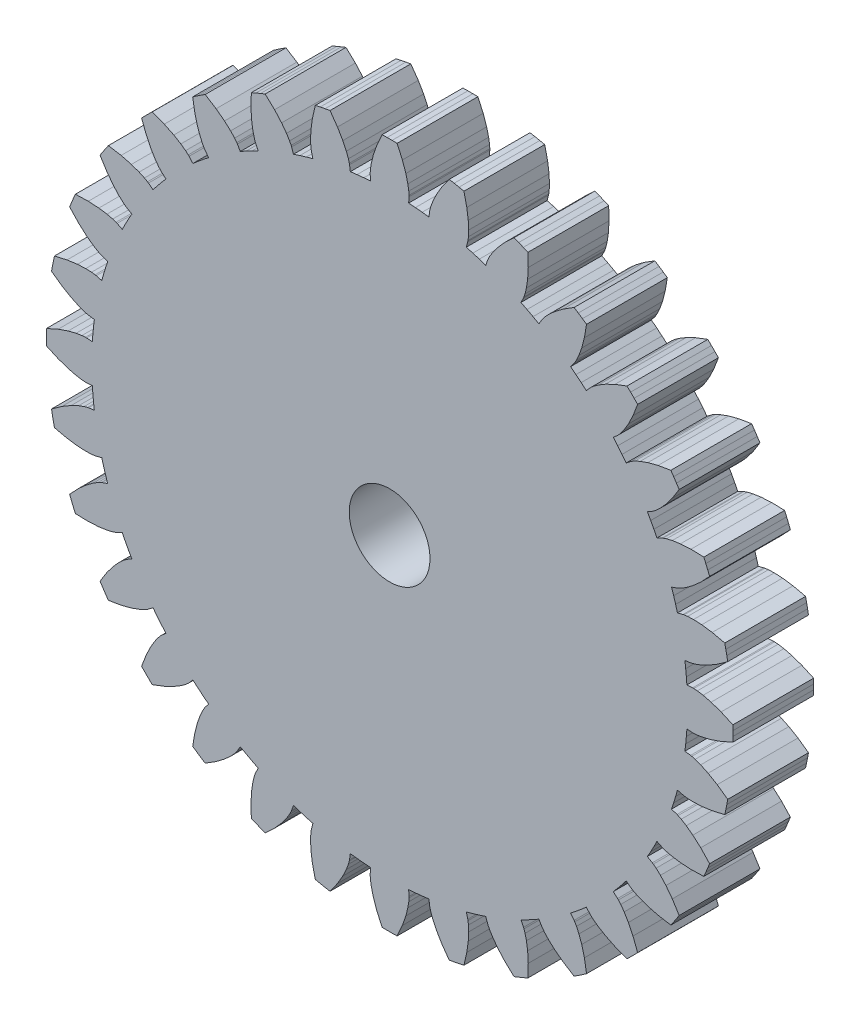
SolidWorks part; units mm, degrees
ref_plane "前视基准面" through (0, 0, 0) normal (0, 0, 1) x (1, 0, 0)
ref_plane "上视基准面" through (0, 0, 0) normal (0, 1, 0) x (1, 0, 0)
ref_plane "右视基准面" through (0, 0, 0) normal (1, 0, 0) x (0, 0, -1)
other "Configuration Table"
sketch "草图1" plane through (0, 0, 0) normal (0, 0, 1) x (1, 0, 0)
  line L0 (22.0797, -1.4149) -> (22.5065, -1.4422)
  line L1 (22.5065, -1.4422) -> (22.5937, -1.4427)
  line L2 (22.5937, -1.4427) -> (22.8546, -1.4236)
  line L3 (22.8546, -1.4236) -> (23.285, -1.3547)
  line L4 (23.285, -1.3547) -> (23.877, -1.2061)
  line L5 (23.877, -1.2061) -> (24.6186, -0.9493)
  line L6 (24.6186, -0.9493) -> (25.4939, -0.5573)
  line L7 (25.4939, -0.5573) -> (25.4993, -0.1858)
  line L8 (25.4993, -0.1858) -> (25.4993, 0.1858)
  line L9 (25.4993, 0.1858) -> (25.4939, 0.5573)
  line L10 (25.4939, 0.5573) -> (24.6186, 0.9493)
  line L11 (24.6186, 0.9493) -> (23.877, 1.2061)
  line L12 (23.877, 1.2061) -> (23.285, 1.3547)
  line L13 (23.285, 1.3547) -> (22.8546, 1.4236)
  line L14 (22.8546, 1.4236) -> (22.5937, 1.4427)
  line L15 (22.5937, 1.4427) -> (22.5065, 1.4422)
  line L16 (22.5065, 1.4422) -> (22.0797, 1.4149)
  line L17 (22.0797, 1.4149) -> (22.0417, 1.9176)
  line L18 (22.0417, 1.9176) -> (21.9923, 2.4194)
  line L19 (21.9923, 2.4194) -> (21.9315, 2.9199)
  line L20 (21.9315, 2.9199) -> (22.3554, 2.9763)
  line L21 (22.3554, 2.9763) -> (22.441, 2.9929)
  line L22 (22.441, 2.9929) -> (22.6931, 3.0624)
  line L23 (22.6931, 3.0624) -> (23.1019, 3.214)
  line L24 (23.1019, 3.214) -> (23.6535, 3.4753)
  line L25 (23.6535, 3.4753) -> (24.3307, 3.8718)
  line L26 (24.3307, 3.8718) -> (25.1128, 4.4271)
  line L27 (25.1128, 4.4271) -> (25.0456, 4.7925)
  line L28 (25.0456, 4.7925) -> (24.9731, 5.1569)
  line L29 (24.9731, 5.1569) -> (24.8953, 5.5202)
  line L30 (24.8953, 5.5202) -> (23.9603, 5.7339)
  line L31 (23.9603, 5.7339) -> (23.1829, 5.8411)
  line L32 (23.1829, 5.8411) -> (22.5733, 5.8713)
  line L33 (22.5733, 5.8713) -> (22.1377, 5.855)
  line L34 (22.1377, 5.855) -> (21.8781, 5.8227)
  line L35 (21.8781, 5.8227) -> (21.7926, 5.8053)
  line L36 (21.7926, 5.8053) -> (21.3794, 5.6952)
  line L37 (21.3794, 5.6952) -> (21.2441, 6.1809)
  line L38 (21.2441, 6.1809) -> (21.0978, 6.6634)
  line L39 (21.0978, 6.6634) -> (20.9404, 7.1424)
  line L40 (20.9404, 7.1424) -> (21.3452, 7.2804)
  line L41 (21.3452, 7.2804) -> (21.4259, 7.3134)
  line L42 (21.4259, 7.3134) -> (21.6597, 7.4308)
  line L43 (21.6597, 7.4308) -> (22.031, 7.6592)
  line L44 (22.031, 7.6592) -> (22.5211, 8.0231)
  line L45 (22.5211, 8.0231) -> (23.1079, 8.5441)
  line L46 (23.1079, 8.5441) -> (23.7666, 9.2413)
  line L47 (23.7666, 9.2413) -> (23.6294, 9.5865)
  line L48 (23.6294, 9.5865) -> (23.4872, 9.9298)
  line L49 (23.4872, 9.9298) -> (23.34, 10.2709)
  line L50 (23.34, 10.2709) -> (22.3813, 10.2981)
  line L51 (22.3813, 10.2981) -> (21.5979, 10.2516)
  line L52 (21.5979, 10.2516) -> (20.9942, 10.1624)
  line L53 (20.9942, 10.1624) -> (20.5701, 10.0613)
  line L54 (20.5701, 10.0613) -> (20.3217, 9.9791)
  line L55 (20.3217, 9.9791) -> (20.2414, 9.9453)
  line L56 (20.2414, 9.9453) -> (19.8576, 9.7567)
  line L57 (19.8576, 9.7567) -> (19.6301, 10.2066)
  line L58 (19.6301, 10.2066) -> (19.3924, 10.6513)
  line L59 (19.3924, 10.6513) -> (19.1447, 11.0904)
  line L60 (19.1447, 11.0904) -> (19.5147, 11.3048)
  line L61 (19.5147, 11.3048) -> (19.5874, 11.3528)
  line L62 (19.5874, 11.3528) -> (19.7938, 11.5136)
  line L63 (19.7938, 11.5136) -> (20.1134, 11.8101)
  line L64 (20.1134, 11.8101) -> (20.5231, 12.2625)
  line L65 (20.5231, 12.2625) -> (20.997, 12.888)
  line L66 (20.997, 12.888) -> (21.507, 13.7003)
  line L67 (21.507, 13.7003) -> (21.3051, 14.0122)
  line L68 (21.3051, 14.0122) -> (21.0987, 14.3211)
  line L69 (21.0987, 14.3211) -> (20.8878, 14.627)
  line L70 (20.8878, 14.627) -> (19.9422, 14.4666)
  line L71 (19.9422, 14.4666) -> (19.183, 14.2682)
  line L72 (19.183, 14.2682) -> (18.6082, 14.0629)
  line L73 (18.6082, 14.0629) -> (18.2119, 13.881)
  line L74 (18.2119, 13.881) -> (17.9844, 13.7519)
  line L75 (17.9844, 13.7519) -> (17.9122, 13.7031)
  line L76 (17.9122, 13.7031) -> (17.5726, 13.4432)
  line L77 (17.5726, 13.4432) -> (17.2617, 13.8402)
  line L78 (17.2617, 13.8402) -> (16.9418, 14.2299)
  line L79 (16.9418, 14.2299) -> (16.6132, 14.6123)
  line L80 (16.6132, 14.6123) -> (16.9343, 14.8947)
  line L81 (16.9343, 14.8947) -> (16.9963, 14.956)
  line L82 (16.9963, 14.956) -> (17.1673, 15.1539)
  line L83 (17.1673, 15.1539) -> (17.4229, 15.5071)
  line L84 (17.4229, 15.5071) -> (17.7364, 16.0308)
  line L85 (17.7364, 16.0308) -> (18.0792, 16.7367)
  line L86 (18.0792, 16.7367) -> (18.421, 17.6329)
  line L87 (18.421, 17.6329) -> (18.1621, 17.8994)
  line L88 (18.1621, 17.8994) -> (17.8994, 18.1621)
  line L89 (17.8994, 18.1621) -> (17.6329, 18.421)
  line L90 (17.6329, 18.421) -> (16.7367, 18.0792)
  line L91 (16.7367, 18.0792) -> (16.0308, 17.7364)
  line L92 (16.0308, 17.7364) -> (15.5071, 17.4229)
  line L93 (15.5071, 17.4229) -> (15.1539, 17.1673)
  line L94 (15.1539, 17.1673) -> (14.956, 16.9963)
  line L95 (14.956, 16.9963) -> (14.8947, 16.9343)
  line L96 (14.8947, 16.9343) -> (14.6123, 16.6132)
  line L97 (14.6123, 16.6132) -> (14.2299, 16.9418)
  line L98 (14.2299, 16.9418) -> (13.8402, 17.2617)
  line L99 (13.8402, 17.2617) -> (13.4432, 17.5726)
  line L100 (13.4432, 17.5726) -> (13.7031, 17.9122)
  line L101 (13.7031, 17.9122) -> (13.7519, 17.9844)
  line L102 (13.7519, 17.9844) -> (13.881, 18.2119)
  line L103 (13.881, 18.2119) -> (14.0629, 18.6082)
  line L104 (14.0629, 18.6082) -> (14.2682, 19.183)
  line L105 (14.2682, 19.183) -> (14.4666, 19.9422)
  line L106 (14.4666, 19.9422) -> (14.627, 20.8878)
  line L107 (14.627, 20.8878) -> (14.3211, 21.0987)
  line L108 (14.3211, 21.0987) -> (14.0122, 21.3051)
  line L109 (14.0122, 21.3051) -> (13.7003, 21.507)
  line L110 (13.7003, 21.507) -> (12.888, 20.997)
  line L111 (12.888, 20.997) -> (12.2625, 20.5231)
  line L112 (12.2625, 20.5231) -> (11.8101, 20.1134)
  line L113 (11.8101, 20.1134) -> (11.5136, 19.7938)
  line L114 (11.5136, 19.7938) -> (11.3528, 19.5874)
  line L115 (11.3528, 19.5874) -> (11.3048, 19.5147)
  line L116 (11.3048, 19.5147) -> (11.0904, 19.1447)
  line L117 (11.0904, 19.1447) -> (10.6513, 19.3924)
  line L118 (10.6513, 19.3924) -> (10.2066, 19.6301)
  line L119 (10.2066, 19.6301) -> (9.7567, 19.8576)
  line L120 (9.7567, 19.8576) -> (9.9453, 20.2414)
  line L121 (9.9453, 20.2414) -> (9.9791, 20.3217)
  line L122 (9.9791, 20.3217) -> (10.0613, 20.5701)
  line L123 (10.0613, 20.5701) -> (10.1624, 20.9942)
  line L124 (10.1624, 20.9942) -> (10.2516, 21.5979)
  line L125 (10.2516, 21.5979) -> (10.2981, 22.3813)
  line L126 (10.2981, 22.3813) -> (10.2709, 23.34)
  line L127 (10.2709, 23.34) -> (9.9298, 23.4872)
  line L128 (9.9298, 23.4872) -> (9.5865, 23.6294)
  line L129 (9.5865, 23.6294) -> (9.2413, 23.7666)
  line L130 (9.2413, 23.7666) -> (8.5441, 23.1079)
  line L131 (8.5441, 23.1079) -> (8.0231, 22.5211)
  line L132 (8.0231, 22.5211) -> (7.6592, 22.031)
  line L133 (7.6592, 22.031) -> (7.4308, 21.6597)
  line L134 (7.4308, 21.6597) -> (7.3134, 21.4259)
  line L135 (7.3134, 21.4259) -> (7.2804, 21.3452)
  line L136 (7.2804, 21.3452) -> (7.1424, 20.9404)
  line L137 (7.1424, 20.9404) -> (6.6634, 21.0978)
  line L138 (6.6634, 21.0978) -> (6.1809, 21.2441)
  line L139 (6.1809, 21.2441) -> (5.6952, 21.3794)
  line L140 (5.6952, 21.3794) -> (5.8053, 21.7926)
  line L141 (5.8053, 21.7926) -> (5.8227, 21.8781)
  line L142 (5.8227, 21.8781) -> (5.855, 22.1377)
  line L143 (5.855, 22.1377) -> (5.8713, 22.5733)
  line L144 (5.8713, 22.5733) -> (5.8411, 23.1829)
  line L145 (5.8411, 23.1829) -> (5.7339, 23.9603)
  line L146 (5.7339, 23.9603) -> (5.5202, 24.8953)
  line L147 (5.5202, 24.8953) -> (5.1569, 24.9731)
  line L148 (5.1569, 24.9731) -> (4.7925, 25.0456)
  line L149 (4.7925, 25.0456) -> (4.4271, 25.1128)
  line L150 (4.4271, 25.1128) -> (3.8718, 24.3307)
  line L151 (3.8718, 24.3307) -> (3.4753, 23.6535)
  line L152 (3.4753, 23.6535) -> (3.214, 23.1019)
  line L153 (3.214, 23.1019) -> (3.0624, 22.6931)
  line L154 (3.0624, 22.6931) -> (2.9929, 22.441)
  line L155 (2.9929, 22.441) -> (2.9763, 22.3554)
  line L156 (2.9763, 22.3554) -> (2.9199, 21.9315)
  line L157 (2.9199, 21.9315) -> (2.4194, 21.9923)
  line L158 (2.4194, 21.9923) -> (1.9176, 22.0417)
  line L159 (1.9176, 22.0417) -> (1.4149, 22.0797)
  line L160 (1.4149, 22.0797) -> (1.4422, 22.5065)
  line L161 (1.4422, 22.5065) -> (1.4427, 22.5937)
  line L162 (1.4427, 22.5937) -> (1.4236, 22.8546)
  line L163 (1.4236, 22.8546) -> (1.3547, 23.285)
  line L164 (1.3547, 23.285) -> (1.2061, 23.877)
  line L165 (1.2061, 23.877) -> (0.9493, 24.6186)
  line L166 (0.9493, 24.6186) -> (0.5573, 25.4939)
  line L167 (0.5573, 25.4939) -> (0.1858, 25.4993)
  line L168 (0.1858, 25.4993) -> (-0.1858, 25.4993)
  line L169 (-0.1858, 25.4993) -> (-0.5573, 25.4939)
  line L170 (-0.5573, 25.4939) -> (-0.9493, 24.6186)
  line L171 (-0.9493, 24.6186) -> (-1.2061, 23.877)
  line L172 (-1.2061, 23.877) -> (-1.3547, 23.285)
  line L173 (-1.3547, 23.285) -> (-1.4236, 22.8546)
  line L174 (-1.4236, 22.8546) -> (-1.4427, 22.5937)
  line L175 (-1.4427, 22.5937) -> (-1.4422, 22.5065)
  line L176 (-1.4422, 22.5065) -> (-1.4149, 22.0797)
  line L177 (-1.4149, 22.0797) -> (-1.9176, 22.0417)
  line L178 (-1.9176, 22.0417) -> (-2.4194, 21.9923)
  line L179 (-2.4194, 21.9923) -> (-2.9199, 21.9315)
  line L180 (-2.9199, 21.9315) -> (-2.9763, 22.3554)
  line L181 (-2.9763, 22.3554) -> (-2.9929, 22.441)
  line L182 (-2.9929, 22.441) -> (-3.0624, 22.6931)
  line L183 (-3.0624, 22.6931) -> (-3.214, 23.1019)
  line L184 (-3.214, 23.1019) -> (-3.4753, 23.6535)
  line L185 (-3.4753, 23.6535) -> (-3.8718, 24.3307)
  line L186 (-3.8718, 24.3307) -> (-4.4271, 25.1128)
  line L187 (-4.4271, 25.1128) -> (-4.7925, 25.0456)
  line L188 (-4.7925, 25.0456) -> (-5.1569, 24.9731)
  line L189 (-5.1569, 24.9731) -> (-5.5202, 24.8953)
  line L190 (-5.5202, 24.8953) -> (-5.7339, 23.9603)
  line L191 (-5.7339, 23.9603) -> (-5.8411, 23.1829)
  line L192 (-5.8411, 23.1829) -> (-5.8713, 22.5733)
  line L193 (-5.8713, 22.5733) -> (-5.855, 22.1377)
  line L194 (-5.855, 22.1377) -> (-5.8227, 21.8781)
  line L195 (-5.8227, 21.8781) -> (-5.8053, 21.7926)
  line L196 (-5.8053, 21.7926) -> (-5.6952, 21.3794)
  line L197 (-5.6952, 21.3794) -> (-6.1809, 21.2441)
  line L198 (-6.1809, 21.2441) -> (-6.6634, 21.0978)
  line L199 (-6.6634, 21.0978) -> (-7.1424, 20.9404)
  line L200 (-7.1424, 20.9404) -> (-7.2804, 21.3452)
  line L201 (-7.2804, 21.3452) -> (-7.3134, 21.4259)
  line L202 (-7.3134, 21.4259) -> (-7.4308, 21.6597)
  line L203 (-7.4308, 21.6597) -> (-7.6592, 22.031)
  line L204 (-7.6592, 22.031) -> (-8.0231, 22.5211)
  line L205 (-8.0231, 22.5211) -> (-8.5441, 23.1079)
  line L206 (-8.5441, 23.1079) -> (-9.2413, 23.7666)
  line L207 (-9.2413, 23.7666) -> (-9.5865, 23.6294)
  line L208 (-9.5865, 23.6294) -> (-9.9298, 23.4872)
  line L209 (-9.9298, 23.4872) -> (-10.2709, 23.34)
  line L210 (-10.2709, 23.34) -> (-10.2981, 22.3813)
  line L211 (-10.2981, 22.3813) -> (-10.2516, 21.5979)
  line L212 (-10.2516, 21.5979) -> (-10.1624, 20.9942)
  line L213 (-10.1624, 20.9942) -> (-10.0613, 20.5701)
  line L214 (-10.0613, 20.5701) -> (-9.9791, 20.3217)
  line L215 (-9.9791, 20.3217) -> (-9.9453, 20.2414)
  line L216 (-9.9453, 20.2414) -> (-9.7567, 19.8576)
  line L217 (-9.7567, 19.8576) -> (-10.2066, 19.6301)
  line L218 (-10.2066, 19.6301) -> (-10.6513, 19.3924)
  line L219 (-10.6513, 19.3924) -> (-11.0904, 19.1447)
  line L220 (-11.0904, 19.1447) -> (-11.3048, 19.5147)
  line L221 (-11.3048, 19.5147) -> (-11.3528, 19.5874)
  line L222 (-11.3528, 19.5874) -> (-11.5136, 19.7938)
  line L223 (-11.5136, 19.7938) -> (-11.8101, 20.1134)
  line L224 (-11.8101, 20.1134) -> (-12.2625, 20.5231)
  line L225 (-12.2625, 20.5231) -> (-12.888, 20.997)
  line L226 (-12.888, 20.997) -> (-13.7003, 21.507)
  line L227 (-13.7003, 21.507) -> (-14.0122, 21.3051)
  line L228 (-14.0122, 21.3051) -> (-14.3211, 21.0987)
  line L229 (-14.3211, 21.0987) -> (-14.627, 20.8878)
  line L230 (-14.627, 20.8878) -> (-14.4666, 19.9422)
  line L231 (-14.4666, 19.9422) -> (-14.2682, 19.183)
  line L232 (-14.2682, 19.183) -> (-14.0629, 18.6082)
  line L233 (-14.0629, 18.6082) -> (-13.881, 18.2119)
  line L234 (-13.881, 18.2119) -> (-13.7519, 17.9844)
  line L235 (-13.7519, 17.9844) -> (-13.7031, 17.9122)
  line L236 (-13.7031, 17.9122) -> (-13.4432, 17.5726)
  line L237 (-13.4432, 17.5726) -> (-13.8402, 17.2617)
  line L238 (-13.8402, 17.2617) -> (-14.2299, 16.9418)
  line L239 (-14.2299, 16.9418) -> (-14.6123, 16.6132)
  line L240 (-14.6123, 16.6132) -> (-14.8947, 16.9343)
  line L241 (-14.8947, 16.9343) -> (-14.956, 16.9963)
  line L242 (-14.956, 16.9963) -> (-15.1539, 17.1673)
  line L243 (-15.1539, 17.1673) -> (-15.5071, 17.4229)
  line L244 (-15.5071, 17.4229) -> (-16.0308, 17.7364)
  line L245 (-16.0308, 17.7364) -> (-16.7367, 18.0792)
  line L246 (-16.7367, 18.0792) -> (-17.6329, 18.421)
  line L247 (-17.6329, 18.421) -> (-17.8994, 18.1621)
  line L248 (-17.8994, 18.1621) -> (-18.1621, 17.8994)
  line L249 (-18.1621, 17.8994) -> (-18.421, 17.6329)
  line L250 (-18.421, 17.6329) -> (-18.0792, 16.7367)
  line L251 (-18.0792, 16.7367) -> (-17.7364, 16.0308)
  line L252 (-17.7364, 16.0308) -> (-17.4229, 15.5071)
  line L253 (-17.4229, 15.5071) -> (-17.1673, 15.1539)
  line L254 (-17.1673, 15.1539) -> (-16.9963, 14.956)
  line L255 (-16.9963, 14.956) -> (-16.9343, 14.8947)
  line L256 (-16.9343, 14.8947) -> (-16.6132, 14.6123)
  line L257 (-16.6132, 14.6123) -> (-16.9418, 14.2299)
  line L258 (-16.9418, 14.2299) -> (-17.2617, 13.8402)
  line L259 (-17.2617, 13.8402) -> (-17.5726, 13.4432)
  line L260 (-17.5726, 13.4432) -> (-17.9122, 13.7031)
  line L261 (-17.9122, 13.7031) -> (-17.9844, 13.7519)
  line L262 (-17.9844, 13.7519) -> (-18.2119, 13.881)
  line L263 (-18.2119, 13.881) -> (-18.6082, 14.0629)
  line L264 (-18.6082, 14.0629) -> (-19.183, 14.2682)
  line L265 (-19.183, 14.2682) -> (-19.9422, 14.4666)
  line L266 (-19.9422, 14.4666) -> (-20.8878, 14.627)
  line L267 (-20.8878, 14.627) -> (-21.0987, 14.3211)
  line L268 (-21.0987, 14.3211) -> (-21.3051, 14.0122)
  line L269 (-21.3051, 14.0122) -> (-21.507, 13.7003)
  line L270 (-21.507, 13.7003) -> (-20.997, 12.888)
  line L271 (-20.997, 12.888) -> (-20.5231, 12.2625)
  line L272 (-20.5231, 12.2625) -> (-20.1134, 11.8101)
  line L273 (-20.1134, 11.8101) -> (-19.7938, 11.5136)
  line L274 (-19.7938, 11.5136) -> (-19.5874, 11.3528)
  line L275 (-19.5874, 11.3528) -> (-19.5147, 11.3048)
  line L276 (-19.5147, 11.3048) -> (-19.1447, 11.0904)
  line L277 (-19.1447, 11.0904) -> (-19.3924, 10.6513)
  line L278 (-19.3924, 10.6513) -> (-19.6301, 10.2066)
  line L279 (-19.6301, 10.2066) -> (-19.8576, 9.7567)
  line L280 (-19.8576, 9.7567) -> (-20.2414, 9.9453)
  line L281 (-20.2414, 9.9453) -> (-20.3217, 9.9791)
  line L282 (-20.3217, 9.9791) -> (-20.5701, 10.0613)
  line L283 (-20.5701, 10.0613) -> (-20.9942, 10.1624)
  line L284 (-20.9942, 10.1624) -> (-21.5979, 10.2516)
  line L285 (-21.5979, 10.2516) -> (-22.3813, 10.2981)
  line L286 (-22.3813, 10.2981) -> (-23.34, 10.2709)
  line L287 (-23.34, 10.2709) -> (-23.4872, 9.9298)
  line L288 (-23.4872, 9.9298) -> (-23.6294, 9.5865)
  line L289 (-23.6294, 9.5865) -> (-23.7666, 9.2413)
  line L290 (-23.7666, 9.2413) -> (-23.1079, 8.5441)
  line L291 (-23.1079, 8.5441) -> (-22.5211, 8.0231)
  line L292 (-22.5211, 8.0231) -> (-22.031, 7.6592)
  line L293 (-22.031, 7.6592) -> (-21.6597, 7.4308)
  line L294 (-21.6597, 7.4308) -> (-21.4259, 7.3134)
  line L295 (-21.4259, 7.3134) -> (-21.3452, 7.2804)
  line L296 (-21.3452, 7.2804) -> (-20.9404, 7.1424)
  line L297 (-20.9404, 7.1424) -> (-21.0978, 6.6634)
  line L298 (-21.0978, 6.6634) -> (-21.2441, 6.1809)
  line L299 (-21.2441, 6.1809) -> (-21.3794, 5.6952)
  line L300 (-21.3794, 5.6952) -> (-21.7926, 5.8053)
  line L301 (-21.7926, 5.8053) -> (-21.8781, 5.8227)
  line L302 (-21.8781, 5.8227) -> (-22.1377, 5.855)
  line L303 (-22.1377, 5.855) -> (-22.5733, 5.8713)
  line L304 (-22.5733, 5.8713) -> (-23.1829, 5.8411)
  line L305 (-23.1829, 5.8411) -> (-23.9603, 5.7339)
  line L306 (-23.9603, 5.7339) -> (-24.8953, 5.5202)
  line L307 (-24.8953, 5.5202) -> (-24.9731, 5.1569)
  line L308 (-24.9731, 5.1569) -> (-25.0456, 4.7925)
  line L309 (-25.0456, 4.7925) -> (-25.1128, 4.4271)
  line L310 (-25.1128, 4.4271) -> (-24.3307, 3.8718)
  line L311 (-24.3307, 3.8718) -> (-23.6535, 3.4753)
  line L312 (-23.6535, 3.4753) -> (-23.1019, 3.214)
  line L313 (-23.1019, 3.214) -> (-22.6931, 3.0624)
  line L314 (-22.6931, 3.0624) -> (-22.441, 2.9929)
  line L315 (-22.441, 2.9929) -> (-22.3554, 2.9763)
  line L316 (-22.3554, 2.9763) -> (-21.9315, 2.9199)
  line L317 (-21.9315, 2.9199) -> (-21.9923, 2.4194)
  line L318 (-21.9923, 2.4194) -> (-22.0417, 1.9176)
  line L319 (-22.0417, 1.9176) -> (-22.0797, 1.4149)
  line L320 (-22.0797, 1.4149) -> (-22.5065, 1.4422)
  line L321 (-22.5065, 1.4422) -> (-22.5937, 1.4427)
  line L322 (-22.5937, 1.4427) -> (-22.8546, 1.4236)
  line L323 (-22.8546, 1.4236) -> (-23.285, 1.3547)
  line L324 (-23.285, 1.3547) -> (-23.877, 1.2061)
  line L325 (-23.877, 1.2061) -> (-24.6186, 0.9493)
  line L326 (-24.6186, 0.9493) -> (-25.4939, 0.5573)
  line L327 (-25.4939, 0.5573) -> (-25.4993, 0.1858)
  line L328 (-25.4993, 0.1858) -> (-25.4993, -0.1858)
  line L329 (-25.4993, -0.1858) -> (-25.4939, -0.5573)
  line L330 (-25.4939, -0.5573) -> (-24.6186, -0.9493)
  line L331 (-24.6186, -0.9493) -> (-23.877, -1.2061)
  line L332 (-23.877, -1.2061) -> (-23.285, -1.3547)
  line L333 (-23.285, -1.3547) -> (-22.8546, -1.4236)
  line L334 (-22.8546, -1.4236) -> (-22.5937, -1.4427)
  line L335 (-22.5937, -1.4427) -> (-22.5065, -1.4422)
  line L336 (-22.5065, -1.4422) -> (-22.0797, -1.4149)
  line L337 (-22.0797, -1.4149) -> (-22.0417, -1.9176)
  line L338 (-22.0417, -1.9176) -> (-21.9923, -2.4194)
  line L339 (-21.9923, -2.4194) -> (-21.9315, -2.9199)
  line L340 (-21.9315, -2.9199) -> (-22.3554, -2.9763)
  line L341 (-22.3554, -2.9763) -> (-22.441, -2.9929)
  line L342 (-22.441, -2.9929) -> (-22.6931, -3.0624)
  line L343 (-22.6931, -3.0624) -> (-23.1019, -3.214)
  line L344 (-23.1019, -3.214) -> (-23.6535, -3.4753)
  line L345 (-23.6535, -3.4753) -> (-24.3307, -3.8718)
  line L346 (-24.3307, -3.8718) -> (-25.1128, -4.4271)
  line L347 (-25.1128, -4.4271) -> (-25.0456, -4.7925)
  line L348 (-25.0456, -4.7925) -> (-24.9731, -5.1569)
  line L349 (-24.9731, -5.1569) -> (-24.8953, -5.5202)
  line L350 (-24.8953, -5.5202) -> (-23.9603, -5.7339)
  line L351 (-23.9603, -5.7339) -> (-23.1829, -5.8411)
  line L352 (-23.1829, -5.8411) -> (-22.5733, -5.8713)
  line L353 (-22.5733, -5.8713) -> (-22.1377, -5.855)
  line L354 (-22.1377, -5.855) -> (-21.8781, -5.8227)
  line L355 (-21.8781, -5.8227) -> (-21.7926, -5.8053)
  line L356 (-21.7926, -5.8053) -> (-21.3794, -5.6952)
  line L357 (-21.3794, -5.6952) -> (-21.2441, -6.1809)
  line L358 (-21.2441, -6.1809) -> (-21.0978, -6.6634)
  line L359 (-21.0978, -6.6634) -> (-20.9404, -7.1424)
  line L360 (-20.9404, -7.1424) -> (-21.3452, -7.2804)
  line L361 (-21.3452, -7.2804) -> (-21.4259, -7.3134)
  line L362 (-21.4259, -7.3134) -> (-21.6597, -7.4308)
  line L363 (-21.6597, -7.4308) -> (-22.031, -7.6592)
  line L364 (-22.031, -7.6592) -> (-22.5211, -8.0231)
  line L365 (-22.5211, -8.0231) -> (-23.1079, -8.5441)
  line L366 (-23.1079, -8.5441) -> (-23.7666, -9.2413)
  line L367 (-23.7666, -9.2413) -> (-23.6294, -9.5865)
  line L368 (-23.6294, -9.5865) -> (-23.4872, -9.9298)
  line L369 (-23.4872, -9.9298) -> (-23.34, -10.2709)
  line L370 (-23.34, -10.2709) -> (-22.3813, -10.2981)
  line L371 (-22.3813, -10.2981) -> (-21.5979, -10.2516)
  line L372 (-21.5979, -10.2516) -> (-20.9942, -10.1624)
  line L373 (-20.9942, -10.1624) -> (-20.5701, -10.0613)
  line L374 (-20.5701, -10.0613) -> (-20.3217, -9.9791)
  line L375 (-20.3217, -9.9791) -> (-20.2414, -9.9453)
  line L376 (-20.2414, -9.9453) -> (-19.8576, -9.7567)
  line L377 (-19.8576, -9.7567) -> (-19.6301, -10.2066)
  line L378 (-19.6301, -10.2066) -> (-19.3924, -10.6513)
  line L379 (-19.3924, -10.6513) -> (-19.1447, -11.0904)
  line L380 (-19.1447, -11.0904) -> (-19.5147, -11.3048)
  line L381 (-19.5147, -11.3048) -> (-19.5874, -11.3528)
  line L382 (-19.5874, -11.3528) -> (-19.7938, -11.5136)
  line L383 (-19.7938, -11.5136) -> (-20.1134, -11.8101)
  line L384 (-20.1134, -11.8101) -> (-20.5231, -12.2625)
  line L385 (-20.5231, -12.2625) -> (-20.997, -12.888)
  line L386 (-20.997, -12.888) -> (-21.507, -13.7003)
  line L387 (-21.507, -13.7003) -> (-21.3051, -14.0122)
  line L388 (-21.3051, -14.0122) -> (-21.0987, -14.3211)
  line L389 (-21.0987, -14.3211) -> (-20.8878, -14.627)
  line L390 (-20.8878, -14.627) -> (-19.9422, -14.4666)
  line L391 (-19.9422, -14.4666) -> (-19.183, -14.2682)
  line L392 (-19.183, -14.2682) -> (-18.6082, -14.0629)
  line L393 (-18.6082, -14.0629) -> (-18.2119, -13.881)
  line L394 (-18.2119, -13.881) -> (-17.9844, -13.7519)
  line L395 (-17.9844, -13.7519) -> (-17.9122, -13.7031)
  line L396 (-17.9122, -13.7031) -> (-17.5726, -13.4432)
  line L397 (-17.5726, -13.4432) -> (-17.2617, -13.8402)
  line L398 (-17.2617, -13.8402) -> (-16.9418, -14.2299)
  line L399 (-16.9418, -14.2299) -> (-16.6132, -14.6123)
  line L400 (-16.6132, -14.6123) -> (-16.9343, -14.8947)
  line L401 (-16.9343, -14.8947) -> (-16.9963, -14.956)
  line L402 (-16.9963, -14.956) -> (-17.1673, -15.1539)
  line L403 (-17.1673, -15.1539) -> (-17.4229, -15.5071)
  line L404 (-17.4229, -15.5071) -> (-17.7364, -16.0308)
  line L405 (-17.7364, -16.0308) -> (-18.0792, -16.7367)
  line L406 (-18.0792, -16.7367) -> (-18.421, -17.6329)
  line L407 (-18.421, -17.6329) -> (-18.1621, -17.8994)
  line L408 (-18.1621, -17.8994) -> (-17.8994, -18.1621)
  line L409 (-17.8994, -18.1621) -> (-17.6329, -18.421)
  line L410 (-17.6329, -18.421) -> (-16.7367, -18.0792)
  line L411 (-16.7367, -18.0792) -> (-16.0308, -17.7364)
  line L412 (-16.0308, -17.7364) -> (-15.5071, -17.4229)
  line L413 (-15.5071, -17.4229) -> (-15.1539, -17.1673)
  line L414 (-15.1539, -17.1673) -> (-14.956, -16.9963)
  line L415 (-14.956, -16.9963) -> (-14.8947, -16.9343)
  line L416 (-14.8947, -16.9343) -> (-14.6123, -16.6132)
  line L417 (-14.6123, -16.6132) -> (-14.2299, -16.9418)
  line L418 (-14.2299, -16.9418) -> (-13.8402, -17.2617)
  line L419 (-13.8402, -17.2617) -> (-13.4432, -17.5726)
  line L420 (-13.4432, -17.5726) -> (-13.7031, -17.9122)
  line L421 (-13.7031, -17.9122) -> (-13.7519, -17.9844)
  line L422 (-13.7519, -17.9844) -> (-13.881, -18.2119)
  line L423 (-13.881, -18.2119) -> (-14.0629, -18.6082)
  line L424 (-14.0629, -18.6082) -> (-14.2682, -19.183)
  line L425 (-14.2682, -19.183) -> (-14.4666, -19.9422)
  line L426 (-14.4666, -19.9422) -> (-14.627, -20.8878)
  line L427 (-14.627, -20.8878) -> (-14.3211, -21.0987)
  line L428 (-14.3211, -21.0987) -> (-14.0122, -21.3051)
  line L429 (-14.0122, -21.3051) -> (-13.7003, -21.507)
  line L430 (-13.7003, -21.507) -> (-12.888, -20.997)
  line L431 (-12.888, -20.997) -> (-12.2625, -20.5231)
  line L432 (-12.2625, -20.5231) -> (-11.8101, -20.1134)
  line L433 (-11.8101, -20.1134) -> (-11.5136, -19.7938)
  line L434 (-11.5136, -19.7938) -> (-11.3528, -19.5874)
  line L435 (-11.3528, -19.5874) -> (-11.3048, -19.5147)
  line L436 (-11.3048, -19.5147) -> (-11.0904, -19.1447)
  line L437 (-11.0904, -19.1447) -> (-10.6513, -19.3924)
  line L438 (-10.6513, -19.3924) -> (-10.2066, -19.6301)
  line L439 (-10.2066, -19.6301) -> (-9.7567, -19.8576)
  line L440 (-9.7567, -19.8576) -> (-9.9453, -20.2414)
  line L441 (-9.9453, -20.2414) -> (-9.9791, -20.3217)
  line L442 (-9.9791, -20.3217) -> (-10.0613, -20.5701)
  line L443 (-10.0613, -20.5701) -> (-10.1624, -20.9942)
  line L444 (-10.1624, -20.9942) -> (-10.2516, -21.5979)
  line L445 (-10.2516, -21.5979) -> (-10.2981, -22.3813)
  line L446 (-10.2981, -22.3813) -> (-10.2709, -23.34)
  line L447 (-10.2709, -23.34) -> (-9.9298, -23.4872)
  line L448 (-9.9298, -23.4872) -> (-9.5865, -23.6294)
  line L449 (-9.5865, -23.6294) -> (-9.2413, -23.7666)
  line L450 (-9.2413, -23.7666) -> (-8.5441, -23.1079)
  line L451 (-8.5441, -23.1079) -> (-8.0231, -22.5211)
  line L452 (-8.0231, -22.5211) -> (-7.6592, -22.031)
  line L453 (-7.6592, -22.031) -> (-7.4308, -21.6597)
  line L454 (-7.4308, -21.6597) -> (-7.3134, -21.4259)
  line L455 (-7.3134, -21.4259) -> (-7.2804, -21.3452)
  line L456 (-7.2804, -21.3452) -> (-7.1424, -20.9404)
  line L457 (-7.1424, -20.9404) -> (-6.6634, -21.0978)
  line L458 (-6.6634, -21.0978) -> (-6.1809, -21.2441)
  line L459 (-6.1809, -21.2441) -> (-5.6952, -21.3794)
  line L460 (-5.6952, -21.3794) -> (-5.8053, -21.7926)
  line L461 (-5.8053, -21.7926) -> (-5.8227, -21.8781)
  line L462 (-5.8227, -21.8781) -> (-5.855, -22.1377)
  line L463 (-5.855, -22.1377) -> (-5.8713, -22.5733)
  line L464 (-5.8713, -22.5733) -> (-5.8411, -23.1829)
  line L465 (-5.8411, -23.1829) -> (-5.7339, -23.9603)
  line L466 (-5.7339, -23.9603) -> (-5.5202, -24.8953)
  line L467 (-5.5202, -24.8953) -> (-5.1569, -24.9731)
  line L468 (-5.1569, -24.9731) -> (-4.7925, -25.0456)
  line L469 (-4.7925, -25.0456) -> (-4.4271, -25.1128)
  line L470 (-4.4271, -25.1128) -> (-3.8718, -24.3307)
  line L471 (-3.8718, -24.3307) -> (-3.4753, -23.6535)
  line L472 (-3.4753, -23.6535) -> (-3.214, -23.1019)
  line L473 (-3.214, -23.1019) -> (-3.0624, -22.6931)
  line L474 (-3.0624, -22.6931) -> (-2.9929, -22.441)
  line L475 (-2.9929, -22.441) -> (-2.9763, -22.3554)
  line L476 (-2.9763, -22.3554) -> (-2.9199, -21.9315)
  line L477 (-2.9199, -21.9315) -> (-2.4194, -21.9923)
  line L478 (-2.4194, -21.9923) -> (-1.9176, -22.0417)
  line L479 (-1.9176, -22.0417) -> (-1.4149, -22.0797)
  line L480 (-1.4149, -22.0797) -> (-1.4422, -22.5065)
  line L481 (-1.4422, -22.5065) -> (-1.4427, -22.5937)
  line L482 (-1.4427, -22.5937) -> (-1.4236, -22.8546)
  line L483 (-1.4236, -22.8546) -> (-1.3547, -23.285)
  line L484 (-1.3547, -23.285) -> (-1.2061, -23.877)
  line L485 (-1.2061, -23.877) -> (-0.9493, -24.6186)
  line L486 (-0.9493, -24.6186) -> (-0.5573, -25.4939)
  line L487 (-0.5573, -25.4939) -> (-0.1858, -25.4993)
  line L488 (-0.1858, -25.4993) -> (0.1858, -25.4993)
  line L489 (0.1858, -25.4993) -> (0.5573, -25.4939)
  line L490 (0.5573, -25.4939) -> (0.9493, -24.6186)
  line L491 (0.9493, -24.6186) -> (1.2061, -23.877)
  line L492 (1.2061, -23.877) -> (1.3547, -23.285)
  line L493 (1.3547, -23.285) -> (1.4236, -22.8546)
  line L494 (1.4236, -22.8546) -> (1.4427, -22.5937)
  line L495 (1.4427, -22.5937) -> (1.4422, -22.5065)
  line L496 (1.4422, -22.5065) -> (1.4149, -22.0797)
  line L497 (1.4149, -22.0797) -> (1.9176, -22.0417)
  line L498 (1.9176, -22.0417) -> (2.4194, -21.9923)
  line L499 (2.4194, -21.9923) -> (2.9199, -21.9315)
  line L500 (2.9199, -21.9315) -> (2.9763, -22.3554)
  line L501 (2.9763, -22.3554) -> (2.9929, -22.441)
  line L502 (2.9929, -22.441) -> (3.0624, -22.6931)
  line L503 (3.0624, -22.6931) -> (3.214, -23.1019)
  line L504 (3.214, -23.1019) -> (3.4753, -23.6535)
  line L505 (3.4753, -23.6535) -> (3.8718, -24.3307)
  line L506 (3.8718, -24.3307) -> (4.4271, -25.1128)
  line L507 (4.4271, -25.1128) -> (4.7925, -25.0456)
  line L508 (4.7925, -25.0456) -> (5.1569, -24.9731)
  line L509 (5.1569, -24.9731) -> (5.5202, -24.8953)
  line L510 (5.5202, -24.8953) -> (5.7339, -23.9603)
  line L511 (5.7339, -23.9603) -> (5.8411, -23.1829)
  line L512 (5.8411, -23.1829) -> (5.8713, -22.5733)
  line L513 (5.8713, -22.5733) -> (5.855, -22.1377)
  line L514 (5.855, -22.1377) -> (5.8227, -21.8781)
  line L515 (5.8227, -21.8781) -> (5.8053, -21.7926)
  line L516 (5.8053, -21.7926) -> (5.6952, -21.3794)
  line L517 (5.6952, -21.3794) -> (6.1809, -21.2441)
  line L518 (6.1809, -21.2441) -> (6.6634, -21.0978)
  line L519 (6.6634, -21.0978) -> (7.1424, -20.9404)
  line L520 (7.1424, -20.9404) -> (7.2804, -21.3452)
  line L521 (7.2804, -21.3452) -> (7.3134, -21.4259)
  line L522 (7.3134, -21.4259) -> (7.4308, -21.6597)
  line L523 (7.4308, -21.6597) -> (7.6592, -22.031)
  line L524 (7.6592, -22.031) -> (8.0231, -22.5211)
  line L525 (8.0231, -22.5211) -> (8.5441, -23.1079)
  line L526 (8.5441, -23.1079) -> (9.2413, -23.7666)
  line L527 (9.2413, -23.7666) -> (9.5865, -23.6294)
  line L528 (9.5865, -23.6294) -> (9.9298, -23.4872)
  line L529 (9.9298, -23.4872) -> (10.2709, -23.34)
  line L530 (10.2709, -23.34) -> (10.2981, -22.3813)
  line L531 (10.2981, -22.3813) -> (10.2516, -21.5979)
  line L532 (10.2516, -21.5979) -> (10.1624, -20.9942)
  line L533 (10.1624, -20.9942) -> (10.0613, -20.5701)
  line L534 (10.0613, -20.5701) -> (9.9791, -20.3217)
  line L535 (9.9791, -20.3217) -> (9.9453, -20.2414)
  line L536 (9.9453, -20.2414) -> (9.7567, -19.8576)
  line L537 (9.7567, -19.8576) -> (10.2066, -19.6301)
  line L538 (10.2066, -19.6301) -> (10.6513, -19.3924)
  line L539 (10.6513, -19.3924) -> (11.0904, -19.1447)
  line L540 (11.0904, -19.1447) -> (11.3048, -19.5147)
  line L541 (11.3048, -19.5147) -> (11.3528, -19.5874)
  line L542 (11.3528, -19.5874) -> (11.5136, -19.7938)
  line L543 (11.5136, -19.7938) -> (11.8101, -20.1134)
  line L544 (11.8101, -20.1134) -> (12.2625, -20.5231)
  line L545 (12.2625, -20.5231) -> (12.888, -20.997)
  line L546 (12.888, -20.997) -> (13.7003, -21.507)
  line L547 (13.7003, -21.507) -> (14.0122, -21.3051)
  line L548 (14.0122, -21.3051) -> (14.3211, -21.0987)
  line L549 (14.3211, -21.0987) -> (14.627, -20.8878)
  line L550 (14.627, -20.8878) -> (14.4666, -19.9422)
  line L551 (14.4666, -19.9422) -> (14.2682, -19.183)
  line L552 (14.2682, -19.183) -> (14.0629, -18.6082)
  line L553 (14.0629, -18.6082) -> (13.881, -18.2119)
  line L554 (13.881, -18.2119) -> (13.7519, -17.9844)
  line L555 (13.7519, -17.9844) -> (13.7031, -17.9122)
  line L556 (13.7031, -17.9122) -> (13.4432, -17.5726)
  line L557 (13.4432, -17.5726) -> (13.8402, -17.2617)
  line L558 (13.8402, -17.2617) -> (14.2299, -16.9418)
  line L559 (14.2299, -16.9418) -> (14.6123, -16.6132)
  line L560 (14.6123, -16.6132) -> (14.8947, -16.9343)
  line L561 (14.8947, -16.9343) -> (14.956, -16.9963)
  line L562 (14.956, -16.9963) -> (15.1539, -17.1673)
  line L563 (15.1539, -17.1673) -> (15.5071, -17.4229)
  line L564 (15.5071, -17.4229) -> (16.0308, -17.7364)
  line L565 (16.0308, -17.7364) -> (16.7367, -18.0792)
  line L566 (16.7367, -18.0792) -> (17.6329, -18.421)
  line L567 (17.6329, -18.421) -> (17.8994, -18.1621)
  line L568 (17.8994, -18.1621) -> (18.1621, -17.8994)
  line L569 (18.1621, -17.8994) -> (18.421, -17.6329)
  line L570 (18.421, -17.6329) -> (18.0792, -16.7367)
  line L571 (18.0792, -16.7367) -> (17.7364, -16.0308)
  line L572 (17.7364, -16.0308) -> (17.4229, -15.5071)
  line L573 (17.4229, -15.5071) -> (17.1673, -15.1539)
  line L574 (17.1673, -15.1539) -> (16.9963, -14.956)
  line L575 (16.9963, -14.956) -> (16.9343, -14.8947)
  line L576 (16.9343, -14.8947) -> (16.6132, -14.6123)
  line L577 (16.6132, -14.6123) -> (16.9418, -14.2299)
  line L578 (16.9418, -14.2299) -> (17.2617, -13.8402)
  line L579 (17.2617, -13.8402) -> (17.5726, -13.4432)
  line L580 (17.5726, -13.4432) -> (17.9122, -13.7031)
  line L581 (17.9122, -13.7031) -> (17.9844, -13.7519)
  line L582 (17.9844, -13.7519) -> (18.2119, -13.881)
  line L583 (18.2119, -13.881) -> (18.6082, -14.0629)
  line L584 (18.6082, -14.0629) -> (19.183, -14.2682)
  line L585 (19.183, -14.2682) -> (19.9422, -14.4666)
  line L586 (19.9422, -14.4666) -> (20.8878, -14.627)
  line L587 (20.8878, -14.627) -> (21.0987, -14.3211)
  line L588 (21.0987, -14.3211) -> (21.3051, -14.0122)
  line L589 (21.3051, -14.0122) -> (21.507, -13.7003)
  line L590 (21.507, -13.7003) -> (20.997, -12.888)
  line L591 (20.997, -12.888) -> (20.5231, -12.2625)
  line L592 (20.5231, -12.2625) -> (20.1134, -11.8101)
  line L593 (20.1134, -11.8101) -> (19.7938, -11.5136)
  line L594 (19.7938, -11.5136) -> (19.5874, -11.3528)
  line L595 (19.5874, -11.3528) -> (19.5147, -11.3048)
  line L596 (19.5147, -11.3048) -> (19.1447, -11.0904)
  line L597 (19.1447, -11.0904) -> (19.3924, -10.6513)
  line L598 (19.3924, -10.6513) -> (19.6301, -10.2066)
  line L599 (19.6301, -10.2066) -> (19.8576, -9.7567)
  line L600 (19.8576, -9.7567) -> (20.2414, -9.9453)
  line L601 (20.2414, -9.9453) -> (20.3217, -9.9791)
  line L602 (20.3217, -9.9791) -> (20.5701, -10.0613)
  line L603 (20.5701, -10.0613) -> (20.9942, -10.1624)
  line L604 (20.9942, -10.1624) -> (21.5979, -10.2516)
  line L605 (21.5979, -10.2516) -> (22.3813, -10.2981)
  line L606 (22.3813, -10.2981) -> (23.34, -10.2709)
  line L607 (23.34, -10.2709) -> (23.4872, -9.9298)
  line L608 (23.4872, -9.9298) -> (23.6294, -9.5865)
  line L609 (23.6294, -9.5865) -> (23.7666, -9.2413)
  line L610 (23.7666, -9.2413) -> (23.1079, -8.5441)
  line L611 (23.1079, -8.5441) -> (22.5211, -8.0231)
  line L612 (22.5211, -8.0231) -> (22.031, -7.6592)
  line L613 (22.031, -7.6592) -> (21.6597, -7.4308)
  line L614 (21.6597, -7.4308) -> (21.4259, -7.3134)
  line L615 (21.4259, -7.3134) -> (21.3452, -7.2804)
  line L616 (21.3452, -7.2804) -> (20.9404, -7.1424)
  line L617 (20.9404, -7.1424) -> (21.0978, -6.6634)
  line L618 (21.0978, -6.6634) -> (21.2441, -6.1809)
  line L619 (21.2441, -6.1809) -> (21.3794, -5.6952)
  line L620 (21.3794, -5.6952) -> (21.7926, -5.8053)
  line L621 (21.7926, -5.8053) -> (21.8781, -5.8227)
  line L622 (21.8781, -5.8227) -> (22.1377, -5.855)
  line L623 (22.1377, -5.855) -> (22.5733, -5.8713)
  line L624 (22.5733, -5.8713) -> (23.1829, -5.8411)
  line L625 (23.1829, -5.8411) -> (23.9603, -5.7339)
  line L626 (23.9603, -5.7339) -> (24.8953, -5.5202)
  line L627 (24.8953, -5.5202) -> (24.9731, -5.1569)
  line L628 (24.9731, -5.1569) -> (25.0456, -4.7925)
  line L629 (25.0456, -4.7925) -> (25.1128, -4.4271)
  line L630 (25.1128, -4.4271) -> (24.3307, -3.8718)
  line L631 (24.3307, -3.8718) -> (23.6535, -3.4753)
  line L632 (23.6535, -3.4753) -> (23.1019, -3.214)
  line L633 (23.1019, -3.214) -> (22.6931, -3.0624)
  line L634 (22.6931, -3.0624) -> (22.441, -2.9929)
  line L635 (22.441, -2.9929) -> (22.3554, -2.9763)
  line L636 (22.3554, -2.9763) -> (21.9315, -2.9199)
  line L637 (21.9315, -2.9199) -> (21.9923, -2.4194)
  line L638 (21.9923, -2.4194) -> (22.0417, -1.9176)
  line L639 (22.0417, -1.9176) -> (22.0797, -1.4149)
  circle A0 centre (0, 0) radius 3
extrude "SpurGear_m1.5_z32" add sketch "草图1" against normal blind 6
